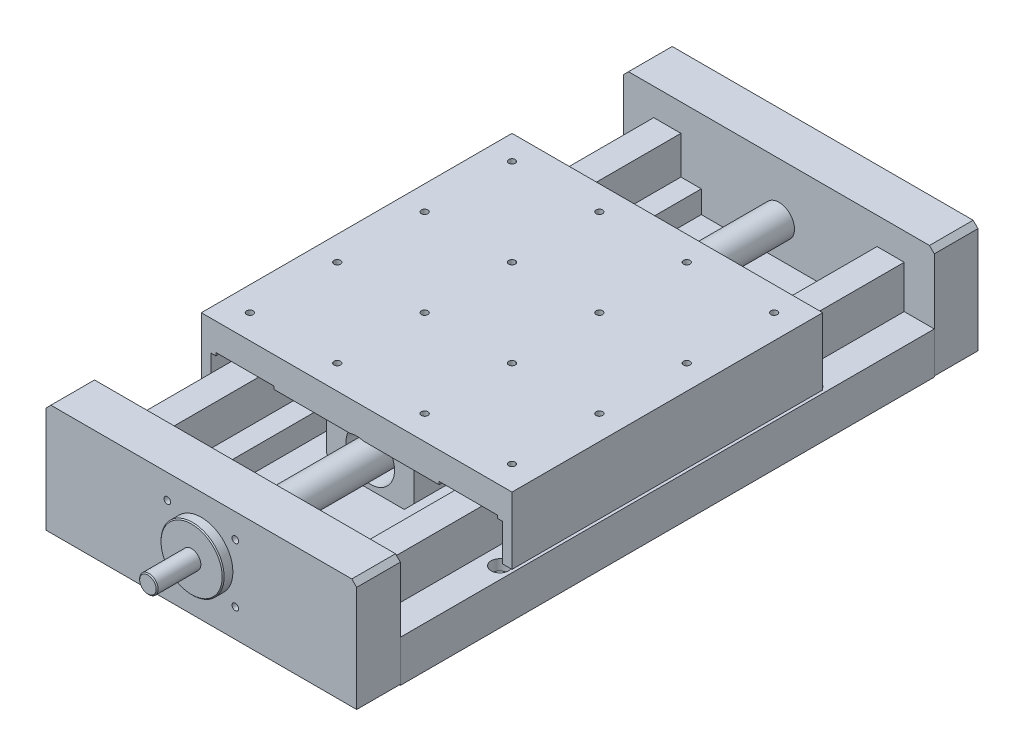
SolidWorks part; units mm, degrees
ref_plane "前视基准面" through (0, 0, 0) normal (0, 0, 1) x (1, 0, 0)
ref_plane "上视基准面" through (0, 0, 0) normal (0, 1, 0) x (1, 0, 0)
ref_plane "右视基准面" through (0, 0, 0) normal (1, 0, 0) x (0, 0, -1)
sketch "草图1" plane through (0, 0, 0) normal (0, 0, 1) x (1, 0, 0)
  line L0 (80, 0) -> (-80, 0)
  line L1 (-80, 0) -> (-80, 23)
  line L2 (-80, 23) -> (-101, 23)
  line L3 (-101, 23) -> (-101, 20)
  line L4 (-101, 20) -> (-129, 20)
  line L5 (-129, 20) -> (-129, 18)
  line L6 (-129, 18) -> (-160, 18)
  line L7 (-160, 18) -> (-160, -25)
  line L8 (-160, -25) -> (160, -25)
  line L9 (0, 0) -> (0, -25) construction
  line L10 (160, 18) -> (160, -25)
  line L11 (129, 18) -> (160, 18)
  line L12 (129, 20) -> (129, 18)
  line L13 (101, 20) -> (129, 20)
  line L14 (101, 23) -> (101, 20)
  line L15 (80, 23) -> (101, 23)
  line L16 (80, 0) -> (80, 23)
  dimension "D1" = 80
  dimension "D2" = 25
  dimension "D3" = 48
  dimension "D4" = 45
  dimension "D5" = 43
  dimension "D6" = 160
  dimension "D7" = 129
  dimension "D8" = 101
extrude "凸台-拉伸1" add sketch "草图1" along normal blind 550
sketch "草图2" plane through (0, 0, 550) normal (0, 0, 1) x (1, 0, 0)
  line L0 (-160, -25) -> (160, -25) construction
  line L1 (-90, -25) -> (90, -25)
  line L2 (-90, -25) -> (-90, -24)
  line L3 (-90, -24) -> (90, -24)
  line L4 (90, -25) -> (90, -24)
  line L5 (0, -24) -> (0, 0) construction
  dimension "D1" = 180
  dimension "D2" = 1
extrude "切除-拉伸1" cut sketch "草图2" against normal through all
sketch "草图3" plane through (0, 20, 0) normal (0, 1, 0) x (1, 0, 0)
  line L0 (0, 0) -> (0, -550) construction
  line L1 (-101, 0) -> (-129, 0)
  line L2 (-101, 0) -> (-101, -550)
  line L3 (-101, -550) -> (-129, -550)
  line L4 (-129, 0) -> (-129, -550)
  line L5 (80, -550) -> (-80, -550) construction
  line L6 (129, 0) -> (129, -550)
  line L7 (101, -550) -> (129, -550)
  line L8 (101, 0) -> (101, -550)
  line L9 (101, 0) -> (129, 0)
extrude "凸台-拉伸2" add sketch "草图3" along normal blind 42 separate body
ref_plane "基准面1" through (0, 0, 275) normal (0, 0, 1) x (1, 0, 0)
sketch "草图4" plane through (0, 0, 275) normal (0, 0, 1) x (1, 0, 0)
  line L0 (0, 0) -> (0, 62) construction
  line L1 (-101, 62) -> (101, 62) construction
  line L2 (-115, 62) -> (-85, 62)
  line L3 (-129, 62) -> (-101, 62) construction
  line L4 (-85, 62) -> (-85, 59)
  line L5 (-85, 59) -> (-45, 59)
  line L6 (-45, 59) -> (-45, 62)
  line L7 (-45, 62) -> (45, 62)
  line L8 (-115, 62) -> (-145, 62)
  line L9 (-145, 62) -> (-145, 59)
  line L10 (-145, 59) -> (-150, 59)
  line L11 (-150, 59) -> (-150, 21)
  line L12 (-150, 21) -> (-160, 21)
  line L13 (-160, 21) -> (-160, 90)
  line L14 (-160, 90) -> (160, 90)
  line L15 (0, 90) -> (0, 62) construction
  line L16 (160, 21) -> (160, 90)
  line L17 (150, 21) -> (160, 21)
  line L18 (150, 59) -> (150, 21)
  line L19 (145, 59) -> (150, 59)
  line L20 (145, 62) -> (145, 59)
  line L21 (115, 62) -> (145, 62)
  line L22 (45, 59) -> (45, 62)
  line L23 (85, 59) -> (45, 59)
  line L24 (85, 62) -> (85, 59)
  line L25 (115, 62) -> (85, 62)
  dimension "D1" = 30
  dimension "D2" = 28
  dimension "D3" = 160
  dimension "D4" = 10
  dimension "D5" = 69
  dimension "D6" = 60
  dimension "D7" = 31
  dimension "D8" = 31
  dimension "D9" = 45
extrude "凸台-拉伸3" add sketch "草图4" along normal mid plane 320
sketch "草图5" plane through (0, 0, 435) normal (0, 0, 1) x (1, 0, 0)
  line L0 (45, 62) -> (45, 59) construction
  line L1 (-45, 62) -> (45, 62)
  line L2 (-45, 62) -> (-45, 5)
  line L3 (-45, 5) -> (45, 5)
  line L4 (45, 62) -> (45, 5)
  line L5 (160, 90) -> (-160, 90) construction
  line L6 (0, 62) -> (0, 35) construction
  circle A0 centre (0, 35) radius 17.5
  dimension "D2" = 55
  dimension "D3" = 35
  dimension "D1" = 85
extrude "凸台-拉伸4" add sketch "草图5" against normal blind 150
chamfer "倒角1" distance 10 angle 45 2 edges at (45, 5, 360) (-45, 5, 360)
sketch "草图6" plane through (0, 0, 435) normal (0, 0, 1) x (1, 0, 0)
  circle A0 centre (0, 35) radius 25
  dimension "D1" = 50
extrude "切除-拉伸2" cut sketch "草图6" against normal blind 90
sketch "草图7" plane through (0, 0, 435) normal (0, 0, 1) x (1, 0, 0)
  line L1 (-45, 59) -> (47.6912, 59)
  line L2 (-45, 59) -> (-45, 3.5297)
  line L3 (-45, 3.5297) -> (47.6912, 3.5297)
  line L4 (47.6912, 59) -> (47.6912, 3.5297)
extrude "切除-拉伸3" cut sketch "草图7" against normal blind 14
sketch "草图8" plane through (0, 0, 550) normal (0, 0, 1) x (1, 0, 0)
  line L0 (160, -25) -> (160, 18) construction
  line L1 (-160, 90) -> (160, 90)
  line L2 (-160, 90) -> (-160, -24)
  line L3 (-160, -24) -> (160, -24)
  line L4 (160, 90) -> (160, -24)
  line L5 (90, -24) -> (-90, -24) construction
extrude "凸台-拉伸5" add sketch "草图8" along normal blind 45 separate body
sketch "草图9" plane through (0, 0, 0) normal (0, 0, -1) x (-1, 0, 0)
  line L0 (160, 18) -> (160, -25) construction
  line L1 (-160, 90) -> (160, 90)
  line L2 (-160, 90) -> (-160, -24)
  line L3 (-160, -24) -> (160, -24)
  line L4 (160, 90) -> (160, -24)
  line L5 (-90, -24) -> (90, -24) construction
extrude "凸台-拉伸6" add sketch "草图9" along normal blind 45 separate body
sketch "草图10" plane through (0, 0, 0) normal (0, 0, 1) x (1, 0, 0)
  line L0 (0, 90) -> (0, 35) construction
  line L1 (-160, 90) -> (160, 90) construction
  circle A0 centre (0, 35) radius 16
  dimension "D2" = 32
  dimension "D1" = 55
extrude "凸台-拉伸7" add sketch "草图10" along normal up to surface (595 mm away) separate body
sketch "草图11" plane through (0, 0, 595) normal (0, 0, 1) x (1, 0, 0)
  circle A0 centre (0, 35) radius 9.5
  dimension "D1" = 19
extrude "凸台-拉伸8" add sketch "草图11" along normal blind 55
sketch "草图12" plane through (0, 0, 595) normal (0, 0, 1) x (1, 0, 0)
  circle A0 centre (0, 35) radius 32.5
  dimension "D1" = 65
extrude "凸台-拉伸9" add sketch "草图12" along normal blind 10
sketch "草图13" plane through (0, 18, 0) normal (0, 1, 0) x (1, 0, 0)
  line L0 (-147.5, 0) -> (-147.5, -550) construction
  line L1 (-160, 0) -> (160, 0) construction
  line L2 (160, -550) -> (-160, -550) construction
  line L3 (0, 0) -> (0, -550) construction
  line L4 (80, -550) -> (-80, -550) construction
  line L5 (-129, 0) -> (-160, 0) construction
  point P11 (-147.5, -115)
  dimension "D1" = 147.5
  dimension "D2" = 115
hole_wizard "打孔尺寸根据内六角圆柱头螺钉的类型1" positions "3D草图1" profile "草图14" counterbore size "M10" standard "GB"
sketch3d "3D草图1"
  point P0 (-147.5, 18, 115)
sketch "草图14" plane through (-147.5, 18, 115) normal (1, 0, 0) x (0, 0, 1)
  line L0 (0, 0) -> (0, 43)
  line L1 (0, 43) -> (5.5, 43)
  line L3 (5.5, 43) -> (5.5, 11)
  line L4 (5.5, 11) -> (9, 11)
  line L5 (9, 11) -> (9, 0)
  line L7 (9, 0) -> (0, 0)
  line L11 (0, -6.35) -> (0, 107.95) construction
  dimension "通孔孔直径" = 11
  dimension "通孔孔深度" = 43
  dimension "柱形沉头孔直径" = 18
  dimension "柱形沉头孔深度" = 11
pattern_linear "阵列(线性)1" count 3 spacing 160 along (0, 0, 1) of "打孔尺寸根据内六角圆柱头螺钉的类型1"
pattern_linear "阵列(线性)2" count 2 spacing 295 along (1, 0, 0) of "打孔尺寸根据内六角圆柱头螺钉的类型1", "阵列(线性)1"
sketch "草图15" plane through (0, 18, 0) normal (0, 1, 0) x (1, 0, 0)
  line L0 (160, -550) -> (160, -540)
  line L1 (160, -550) -> (160, 0) construction
  line L2 (160, -540) -> (150, -530)
  line L3 (150, -530) -> (160, -520)
  line L4 (150, -530) -> (160, -530) construction
  line L21 (160, -520) -> (150, -510)
  line L22 (150, -510) -> (160, -500)
  line L23 (160, -500) -> (150, -490)
  line L24 (150, -490) -> (160, -480)
  line L25 (160, -480) -> (150, -470)
  line L26 (150, -470) -> (160, -460)
  line L27 (160, -460) -> (150, -450)
  line L28 (150, -450) -> (160, -440)
  line L29 (160, -440) -> (150, -430)
  line L30 (150, -430) -> (160, -420)
  line L31 (160, -420) -> (150, -410)
  line L32 (150, -410) -> (160, -400)
  line L33 (160, -400) -> (150, -390)
  line L34 (150, -390) -> (160, -380)
  line L35 (160, -380) -> (150, -370)
  line L36 (150, -370) -> (160, -360)
  line L43 (160, -360) -> (150, -350)
  line L44 (150, -350) -> (160, -340)
  line L45 (160, -340) -> (150, -330)
  line L46 (150, -330) -> (160, -320)
  line L49 (160, -320) -> (150, -310)
  line L50 (150, -310) -> (160, -300)
  dimension "D1" = 10
  dimension "D2" = 20
  dimension "D3" = 45
  dimension "D4" = 45
  dimension "D5" = 6
sketch "草图16" plane through (0, 0, 550) normal (0, 0, -1) x (-1, 0, 0)
  line L0 (-160, 18) -> (-160, 90)
  line L1 (-160, 90) -> (160, 90)
  line L2 (160, 90) -> (160, 18)
  line L3 (0, 90) -> (0, 0) construction
surface "曲面-扫描1" [suppressed]
mirror "镜向3" [suppressed] about plane through (0, 0, 275) normal (0, 0, 1)
sketch "草图17" plane through (0, 0, 595) normal (0, 0, 1) x (1, 0, 0)
  line L0 (160, 90) -> (-160, 90) construction
  line L1 (-280, 87) -> (80, 87)
  line L2 (-280, 87) -> (-280, -23)
  line L3 (-280, -23) -> (80, -23)
  line L4 (80, 87) -> (80, -23)
  line L5 (-160, 90) -> (-160, -24) construction
  circle A0 centre (0, 35) radius 9.5 construction
  circle A1 centre (0, 35) radius 40
  dimension "D4" = 80
  dimension "D1" = 110
  dimension "D2" = 120
  dimension "D3" = 80
  dimension "D5" = 3
extrude "凸台-拉伸10" [suppressed] add sketch "草图17" along normal blind 15 separate body
sketch "草图18" [suppressed] plane through (0, 0, 570) normal (0, 0, 1) x (1, 0, 0)
  line L0 (0, 35) -> (-225, 32) construction
  line L1 (-280, 32) -> (-225, 32) construction
  line L2 (-280, 87) -> (-280, -23) construction
  circle A0 centre (-225, 32) radius 30
  dimension "D2" = 60
  dimension "D1" = 55
extrude "切除-拉伸4" [suppressed] cut sketch "草图18" against normal through all
sketch "草图19" [suppressed] plane through (0, 0, 555) normal (0, 0, -1) x (-1, 0, 0)
  line L0 (225, 87) -> (225, 32) construction
  line L1 (170, 87) -> (280, 87)
  line L2 (170, 87) -> (170, -23)
  line L3 (170, -23) -> (280, -23)
  line L4 (280, 87) -> (280, -23)
  line L5 (225, 32) -> (280, 32) construction
  dimension "D1" = 110
  dimension "D2" = 110
extrude "凸台-拉伸11" [suppressed] add sketch "草图19" along normal blind 150 separate body
sketch "草图20" [suppressed] plane through (0, 0, 555) normal (0, 0, 1) x (1, 0, 0)
  circle A0 centre (-225, 32) radius 9.5
  dimension "D1" = 19
extrude "凸台-拉伸12" [suppressed] add sketch "草图20" along normal blind 54 separate body
sketch "草图21" [suppressed] plane through (0, 0, 405) normal (0, 0, -1) x (-1, 0, 0)
  circle A0 centre (280, 87) radius 25
  dimension "D1" = 50
extrude "切除-拉伸5" [suppressed] cut sketch "草图21" against normal blind 138
pattern_circular "阵列(圆周)1" [suppressed] count 4 over 360
fillet "圆角1" [suppressed] radius 5
fillet "圆角2" [suppressed] radius 5
fillet "圆角3" [suppressed] radius 5
sketch "草图22" [suppressed] plane through (0, 0, 610) normal (0, 0, 1) x (1, 0, 0)
  circle A0 centre (0, 35) radius 34.865
  circle A1 centre (-225, 32) radius 34.865
  dimension "D1" = 69.73
  dimension "D2" = 69.73
extrude "凸台-拉伸13" [suppressed] add sketch "草图22" against normal blind 26 separate body
sketch "草图23" [suppressed] plane through (0, 0, 610) normal (0, 0, 1) x (1, 0, 0)
  circle A0 centre (0, 35) radius 39
  circle A1 centre (-225, 32) radius 39
  dimension "D1" = 78
  dimension "D2" = 78
extrude "凸台-拉伸14" [suppressed] add sketch "草图23" along normal blind 2.5
sketch "草图24" [suppressed] plane through (0, 0, 584) normal (0, 0, -1) x (-1, 0, 0)
  circle A0 centre (0, 35) radius 39
  circle A1 centre (225, 32) radius 39
extrude "凸台-拉伸15" [suppressed] add sketch "草图24" along normal blind 2.5
sketch "草图25" [suppressed] plane through (0, 0, 555) normal (0, 0, 1) x (1, 0, 0)
  line L0 (75, 87) -> (-275, 87) construction
  line L1 (77.5, 87.5) -> (-277.5, 87.5)
  line L2 (80.5, 84.5) -> (80.5, -20.5)
  line L3 (77.5, -23.5) -> (-277.5, -23.5)
  line L4 (-280.5, 84.5) -> (-280.5, -20.5)
  line L5 (-280, 82) -> (-280, -18) construction
  line L6 (-275, -23) -> (75, -23) construction
  line L7 (80, -18) -> (80, 82) construction
  line L8 (77.5, 88.5) -> (-277.5, 88.5)
  line L9 (-281.5, 84.5) -> (-281.5, -20.5)
  line L10 (77.5, -24.5) -> (-277.5, -24.5)
  line L11 (81.5, 84.5) -> (81.5, -20.5)
  arc A0 (80.5, 84.5) -> (77.5, 87.5) centre (77.5, 84.5) ccw
  arc A1 (77.5, -23.5) -> (80.5, -20.5) centre (77.5, -20.5) ccw
  arc A2 (-277.5, -23.5) -> (-280.5, -20.5) centre (-277.5, -20.5) cw
  arc A3 (-280.5, 84.5) -> (-277.5, 87.5) centre (-277.5, 84.5) cw
  arc A4 (-281.5, 84.5) -> (-277.5, 88.5) centre (-277.5, 84.5) cw
  arc A5 (-277.5, -24.5) -> (-281.5, -20.5) centre (-277.5, -20.5) cw
  arc A6 (77.5, -24.5) -> (81.5, -20.5) centre (77.5, -20.5) ccw
  arc A7 (81.5, 84.5) -> (77.5, 88.5) centre (77.5, 84.5) ccw
  dimension "D5" = 3
  dimension "D1" = 0.5
  dimension "D2" = 0.5
  dimension "D3" = 0.5
  dimension "D4" = 0.5
  dimension "D6" = 1
extrude "凸台-拉伸16" [suppressed] add sketch "草图25" along normal blind 70 separate body
sketch "草图26" [suppressed] plane through (0, 0, 625) normal (0, 0, 1) x (1, 0, 0)
  line L0 (-281.5, 84.5) -> (-281.5, -20.5)
  line L1 (-277.5, -24.5) -> (77.5, -24.5) construction
  line L2 (-277.5, 88.5) -> (77.5, 88.5)
  line L3 (81.5, 84.5) -> (81.5, -20.5)
  line L4 (77.5, -24.5) -> (-277.5, -24.5)
  arc A0 (-281.5, -20.5) -> (-277.5, -24.5) centre (-277.5, -20.5) ccw
  arc A1 (77.5, -24.5) -> (81.5, -20.5) centre (77.5, -20.5) ccw
  arc A2 (77.5, -24.5) -> (81.5, -20.5) centre (77.5, -20.5) ccw construction
  arc A3 (81.5, 84.5) -> (77.5, 88.5) centre (77.5, 84.5) ccw
  arc A4 (81.5, 84.5) -> (77.5, 88.5) centre (77.5, 84.5) ccw construction
  arc A5 (-277.5, 88.5) -> (-281.5, 84.5) centre (-277.5, 84.5) ccw
extrude "凸台-拉伸17" [suppressed] add sketch "草图26" along normal blind 1 separate body
sketch "草图27" plane through (0, 0, 595) normal (0, 0, 1) x (1, 0, 0)
  line L0 (0, 35) -> (0, 90) construction
  line L1 (-55, 90) -> (55, 90)
  line L2 (-55, 90) -> (-55, -20)
  line L3 (-55, -20) -> (55, -20)
  line L4 (55, 90) -> (55, -20)
  line L5 (55, 35) -> (0, 35) construction
  circle A0 centre (0, 35) radius 40
  dimension "D3" = 80
  dimension "D1" = 110
  dimension "D2" = 110
extrude "凸台-拉伸18" [suppressed] add sketch "草图27" along normal blind 12 separate body
sketch "草图28" [suppressed] plane through (0, 0, 857) normal (0, 0, 1) x (1, 0, 0)
  line L0 (-55, -20) -> (55, -20) construction
  line L1 (-55, 90) -> (-43, 90)
  line L2 (-55, 90) -> (-55, -20)
  line L3 (-55, -20) -> (-43, -20)
  line L4 (-43, 90) -> (-43, -20)
  line L5 (0, 35) -> (0, 90) construction
  line L6 (55, 90) -> (-55, 90) construction
  line L7 (43, 90) -> (43, -20)
  line L8 (55, -20) -> (43, -20)
  line L9 (55, 90) -> (55, -20)
  line L10 (55, 90) -> (43, 90)
  dimension "D1" = 12
extrude "凸台-拉伸19" [suppressed] add sketch "草图28" along normal blind 110 separate body
sketch "草图29" [suppressed] plane through (0, 0, 967) normal (0, 0, 1) x (1, 0, 0)
  line L0 (0, 35) -> (-55, 35) construction
  line L1 (-55, 90) -> (55, 90)
  line L2 (-55, 90) -> (-55, -20)
  line L3 (-55, -20) -> (55, -20)
  line L4 (55, 90) -> (55, -20)
  line L6 (-55, 90) -> (-55, -20) construction
  line L7 (55, -20) -> (55, 90) construction
  circle A0 centre (0, 35) radius 40
  dimension "D1" = 110
extrude "凸台-拉伸20" [suppressed] add sketch "草图29" along normal blind 15
sketch "草图30" [suppressed] plane through (0, 0, 982) normal (0, 0, 1) x (1, 0, 0)
  line L1 (-55, 90) -> (55, 90)
  line L2 (-55, 90) -> (-55, -20)
  line L3 (-55, -20) -> (55, -20)
  line L4 (55, 90) -> (55, -20)
extrude "凸台-拉伸21" [suppressed] add sketch "草图30" along normal blind 150 separate body
sketch "草图31" [suppressed] plane through (0, 0, 982) normal (0, 0, -1) x (-1, 0, 0)
  circle A0 centre (0, 31.616) radius 9.5
  dimension "D1" = 19
extrude "凸台-拉伸22" [suppressed] add sketch "草图31" along normal blind 56 separate body
sketch "草图32" [suppressed] plane through (0, 0, 1132) normal (0, 0, 1) x (1, 0, 0)
  line L0 (0, 90) -> (0, 35) construction
  line L1 (55, 90) -> (-55, 90) construction
  line L2 (0, 35) -> (55, 35) construction
  line L3 (55, -20) -> (55, 90) construction
  circle A0 centre (-55, 90) radius 22.5
  circle A1 centre (55, 90) radius 22.5
  circle A2 centre (-55, -20) radius 22.5
  circle A3 centre (55, -20) radius 22.5
  dimension "D1" = 45
extrude "切除-拉伸6" [suppressed] cut sketch "草图32" against normal blind 140
sketch "草图33" [suppressed] plane through (-55, 0, 0) normal (-1, 0, 0) x (0, 0, 1)
  line L0 (982, 90) -> (982, -20) construction
  line L1 (857, 90) -> (967, 90)
  line L2 (857, 90) -> (857, 75)
  line L3 (857, 75) -> (967, 75)
  line L4 (967, 90) -> (967, 75)
  line L5 (857, 35) -> (982, 35) construction
  line L6 (857, 90) -> (857, -20) construction
  line L7 (967, -20) -> (967, -5)
  line L8 (857, -5) -> (967, -5)
  line L9 (857, -20) -> (857, -5)
  line L10 (857, -20) -> (967, -20)
  line L11 (982, 90) -> (982, -20) construction
  dimension "D1" = 15
  dimension "D2" = 15
extrude "切除-拉伸8" [suppressed] cut sketch "草图33" against normal through all
sketch "草图34" plane through (0, 90, 0) normal (0, 1, 0) x (1, 0, 0)
  line L0 (-135, -140) -> (-45, -140) construction
  line L1 (-45, -140) -> (-45, -230) construction
  line L2 (-45, -230) -> (-135, -230) construction
  line L3 (-135, -230) -> (-135, -140) construction
  line L4 (0, -115) -> (0, -435) construction
  line L5 (160, -115) -> (-160, -115) construction
  line L6 (160, -435) -> (-160, -435) construction
  line L7 (-160, -275) -> (160, -275) construction
  line L8 (-160, -435) -> (-160, -115) construction
  line L9 (160, -435) -> (160, -115) construction
  line L10 (135, -230) -> (135, -140) construction
  line L11 (45, -230) -> (135, -230) construction
  line L12 (45, -140) -> (45, -230) construction
  line L13 (135, -140) -> (45, -140) construction
  line L14 (135, -410) -> (45, -410) construction
  line L15 (45, -410) -> (45, -320) construction
  line L16 (45, -320) -> (135, -320) construction
  line L17 (135, -320) -> (135, -410) construction
  line L18 (-135, -320) -> (-135, -410) construction
  line L19 (-45, -320) -> (-135, -320) construction
  line L20 (-45, -410) -> (-45, -320) construction
  line L21 (-135, -410) -> (-45, -410) construction
  dimension "D1" = 90
  dimension "D2" = 45
  dimension "D3" = 45
  dimension "D4" = 90
hole_wizard "M8 螺纹孔1" positions "3D草图2" profile "草图35" tap size "M8" standard "ISO"
sketch3d "3D草图2"
  point P0 (-135, 90, 140)
  point P3 (-135, 90, 230)
  point P6 (-45, 90, 230)
  point P9 (-45, 90, 140)
  point P12 (45, 90, 140)
  point P15 (45, 90, 230)
  point P18 (135, 90, 230)
  point P21 (135, 90, 140)
  point P24 (135, 90, 320)
  point P27 (135, 90, 410)
  point P30 (45, 90, 410)
  point P33 (45, 90, 320)
  point P36 (-45, 90, 320)
  point P39 (-45, 90, 410)
  point P42 (-135, 90, 320)
  point P45 (-135, 90, 410)
sketch "草图35" plane through (-135, 90, 140) normal (1, 0, 0) x (0, 0, 1)
  line L0 (0, 0) -> (0, 21.7929)
  line L1 (0, 21.7929) -> (3.4, 19.75)
  line L2 (3.4, 19.75) -> (3.4, 0)
  line L5 (3.4, 0) -> (0, 0)
  line L10 (0, 21.7929) -> (-3.4, 19.75) construction
  line L11 (0, -6.35) -> (0, 107.95) construction
  dimension "螺纹孔钻头直径" = 6.8
  dimension "螺纹孔钻头深度" = 19.75
  dimension "导头角度" = 118
chamfer "倒角2" distance 5 angle 45 2 edges at (160, 90, 572.5) (-160, 90, 572.5)
chamfer "倒角3" distance 5 angle 45 2 edges at (-160, 90, -22.5) (160, 90, -22.5)
sketch "草图36" plane through (0, 0, 595) normal (0, 0, 1) x (1, 0, 0)
  line L0 (0, 35) -> (0, 5) construction
  line L1 (-35, 65) -> (35, 65) construction
  line L2 (-35, 65) -> (-35, 5) construction
  line L3 (-35, 5) -> (35, 5) construction
  line L4 (35, 65) -> (35, 5) construction
  line L5 (0, 35) -> (35, 35) construction
  dimension "D1" = 70
  dimension "D2" = 60
hole_wizard "M8 螺纹孔2" positions "3D草图3" profile "草图37" tap size "M8" standard "GB"
sketch3d "3D草图3"
  point P0 (-35, 65, 595)
  point P3 (-35, 5, 595)
  point P6 (35, 5, 595)
  point P9 (35, 65, 595)
sketch "草图37" plane through (-35, 65, 595) normal (1, 0, 0) x (0, -1, 0)
  line L0 (0, 0) -> (0, 21.7929)
  line L1 (0, 21.7929) -> (3.4, 19.75)
  line L2 (3.4, 19.75) -> (3.4, 0)
  line L5 (3.4, 0) -> (0, 0)
  line L10 (0, 21.7929) -> (-3.4, 19.75) construction
  line L11 (0, -6.35) -> (0, 107.95) construction
  dimension "螺纹孔钻头直径" = 6.8
  dimension "螺纹孔钻头深度" = 19.75
  dimension "导头角度" = 118
chamfer "倒角4" distance 1 angle 45 2 edges at (9.5, 35, 650) (32.5, 35, 605)
